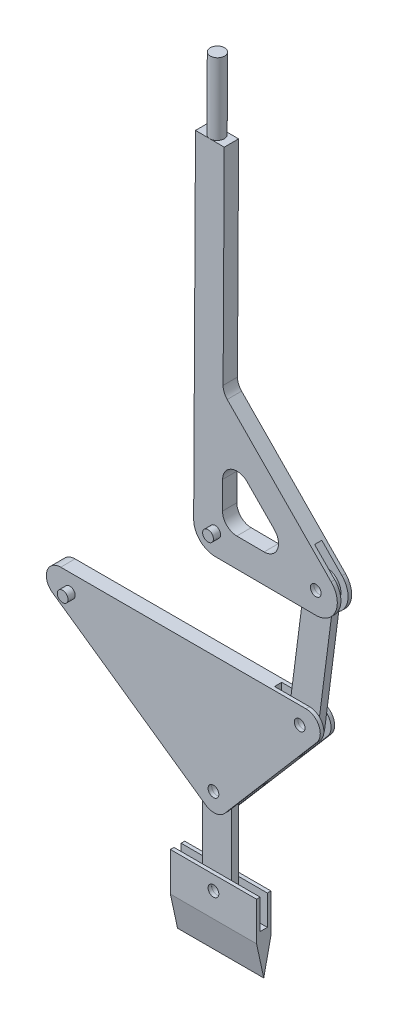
SolidWorks part; units mm, degrees
other "Blade"
other "Link2"
other "Link1"
other "Center Link"
other "Hand Link"
other "pin1"
other "pin2"
ref_plane "Front Plane" through (0, 0, 0) normal (0, 0, 1) x (1, 0, 0)
ref_plane "Top Plane" through (0, 0, 0) normal (0, 1, 0) x (1, 0, 0)
ref_plane "Right Plane" through (0, 0, 0) normal (1, 0, 0) x (0, 0, -1)
sketch "Center link" plane through (0, 0, 0) normal (0, 0, 1) x (1, 0, 0)
  line L0 (0, 0) -> (254, -177.8) construction
  line L3 (254, -177.8) -> (406.4, 0) construction
  line L4 (406.4, 0) -> (0, 0) construction
  line L5 (417.445, 30.48) -> (-16.1156, 30.48)
  line L6 (-30.6816, -15.7285) -> (240.2939, -205.4113)
  line L7 (274.1449, -201.1329) -> (436.7302, -11.4501)
  line L8 (472.6702, 30.48) -> (-96.6937, 30.48) construction
  line L9 (259.1588, -218.6167) -> (472.6702, 30.48) construction
  line L10 (-96.6937, 30.48) -> (259.1588, -218.6167) construction
  arc A2 (417.445, 30.48) -> (436.7302, -11.4501) centre (417.445, 5.08) cw
  arc A3 (240.2939, -205.4113) -> (274.1449, -201.1329) centre (254.8598, -184.6028) ccw
  arc A4 (-16.1156, 30.48) -> (-30.6816, -15.7285) centre (-16.1156, 5.08) ccw
  circle A5 centre (0, 0) radius 9.525
  circle A6 centre (406.4, 0) radius 9.525
  circle A7 centre (254, -177.8) radius 9.525
  point P0 (0, 0)
  point P1 (254, -177.8)
  point P3 (406.4, 0)
  dimension "D2" = 25.4
  dimension "D6" = 19.05
  dimension "D3" = 406.4
  dimension "D4" = 177.8
  dimension "D5" = 152.4
  dimension "D1" = 30.48
sketch "Link 2" plane through (0, 0, 0) normal (0, 0, 1) x (1, 0, 0)
  line L0 (254, -177.8) -> (254, -330.2) construction
  line L1 (279.4, -177.8) -> (279.4, -330.2)
  line L2 (228.6, -177.8) -> (228.6, -330.2)
  arc A0 (279.4, -177.8) -> (228.6, -177.8) centre (254, -177.8) ccw
  arc A1 (228.6, -330.2) -> (279.4, -330.2) centre (254, -330.2) ccw
  circle A2 centre (254, -330.2) radius 9.525
  circle A3 centre (254, -177.8) radius 9.525
  circle A4 centre (254, -177.8) radius 9.525 construction
  point P3 (254, -254)
  dimension "D2" = 25.4
  dimension "D1" = 152.4
sketch "Blade" plane through (0, 0, 0) normal (0, 0, 1) x (1, 0, 0)
  line L0 (254, -177.8) -> (254, -330.2) construction
  line L1 (177.8, -304.8) -> (330.2, -304.8)
  line L2 (177.8, -304.8) -> (177.8, -431.8)
  line L3 (177.8, -431.8) -> (330.2, -431.8)
  line L4 (330.2, -304.8) -> (330.2, -431.8)
  circle A0 centre (254, -330.2) radius 9.525
  circle A1 centre (254, -330.2) radius 9.525 construction
  point P6 (254, -304.8)
  dimension "D1" = 152.4
  dimension "D2" = 127
  dimension "D3" = 25.4
sketch "Hand Link" plane through (0, 0, 0) normal (0, 0, 1) x (1, 0, 0)
  line L1 (222.2172, 818.5071) -> (273.0164, 818.2299)
  line L3 (295.2285, 233.9) -> (343.5024, 233.6366)
  line L4 (256.8519, 183.3087) -> (434.6519, 182.3385)
  line L6 (218.9603, 221.616) -> (222.2172, 818.5071)
  line L7 (269.9674, 259.4382) -> (270.2331, 308.1268)
  line L9 (278.2856, 434.5038) -> (462.0614, 247.1152)
  line L10 (313.7672, 325.7731) -> (361.7754, 276.8211)
  line L11 (271.0205, 452.4273) -> (273.0164, 818.2299)
  circle A0 centre (257.0597, 221.4081) radius 9.525
  circle A1 centre (434.8597, 220.4379) radius 9.525
  arc A3 (218.9603, 221.616) -> (256.8519, 183.3087) centre (257.0597, 221.4081) ccw
  arc A4 (434.6519, 182.3385) -> (462.0614, 247.1152) centre (434.8597, 220.4379) ccw
  arc A5 (218.9603, 221.616) -> (256.8519, 183.3087) centre (257.0597, 221.4081) ccw
  arc A7 (269.9674, 259.4382) -> (295.2285, 233.9) centre (295.3671, 259.2996) ccw
  arc A9 (434.6519, 182.3385) -> (462.0614, 247.1152) centre (434.8597, 220.4379) ccw
  arc A10 (278.2856, 434.5038) -> (271.0205, 452.4273) centre (296.4201, 452.2887) cw
  arc A11 (361.7754, 276.8211) -> (343.5024, 233.6366) centre (343.6409, 259.0362) cw
  arc A12 (313.7672, 325.7731) -> (270.2331, 308.1268) centre (295.6327, 307.9882) ccw
  point P0 (257.0597, 221.4081)
  point P1 (434.8597, 220.4379)
  point P28 (270.9634, 441.97)
  dimension "D1" = 19.05
  dimension "D2" = 25.4
  dimension "D3" = 25.4
  dimension "D4" = 25.4
  dimension "D8" = 38.1
  dimension "D9" = 38.1
  dimension "D5" = 50.8
  dimension "D6" = 50.8
  dimension "D7" = 50.8
  dimension "D10" = 177.8
  dimension "D11" = 635
sketch "Link 1" plane through (0, 0, 0) normal (0, 0, 1) x (1, 0, 0)
  line L0 (434.8597, 220.4379) -> (406.4, 0) construction
  line L1 (460.0507, 217.1857) -> (431.5909, -3.2523)
  line L2 (409.6688, 223.6902) -> (381.2091, 3.2523)
  arc A0 (460.0507, 217.1857) -> (409.6688, 223.6902) centre (434.8597, 220.4379) ccw
  arc A1 (381.2091, 3.2523) -> (431.5909, -3.2523) centre (406.4, 0) ccw
  circle A2 centre (434.8597, 220.4379) radius 9.525
  circle A3 centre (406.4, 0) radius 9.525
  point P4 (420.6299, 110.219)
  dimension "D2" = 19.05
  dimension "D1" = 50.8
extrude "Boss-Extrude1" add sketch "Blade" along normal mid plane 25.4 contours L3 L4 L1 L2 | A0
sketch "Sketch7" plane through (177.8, 0, 0) normal (-1, 0, 0) x (0, 0, 1)
  line L0 (0, -431.8) -> (12.7, -373.0751)
  line L1 (12.7, -431.8) -> (-12.7, -431.8) construction
  line L2 (12.7, -304.8) -> (12.7, -431.8) construction
  line L3 (0, -431.8) -> (-12.7, -373.0751)
  line L4 (-12.7, -304.8) -> (-12.7, -431.8) construction
extrude "Cut-Extrude2" cut sketch "Sketch7" against normal through all and the other way through all
sketch "Sketch8" plane through (177.8, 0, 0) normal (-1, 0, 0) x (0, 0, 1)
  line L0 (0, -177.8) -> (0, -330.2) construction
  line L1 (6.35, -250.5495) -> (-6.35, -250.5495)
  line L2 (6.35, -250.5495) -> (6.35, -357.4599)
  line L3 (6.35, -357.4599) -> (-6.35, -357.4599)
  line L4 (-6.35, -250.5495) -> (-6.35, -357.4599)
  line L5 (6.35, -250.5495) -> (-6.35, -357.4599) construction
  line L6 (6.35, -357.4599) -> (-6.35, -250.5495) construction
  point P0 (0, -304.0047)
  dimension "D1" = 12.7
extrude "Cut-Extrude3" cut sketch "Sketch8" against normal through all contours L3 L4 L1 L2
extrude "Boss-Extrude2" add sketch "Link 2" along normal mid plane 12.7 separate body contours L1 A1 L2 A0
extrude "Boss-Extrude3" add sketch "Link 1" along normal mid plane 12.7 separate body contours L2 A1 L1 A0
extrude "Boss-Extrude4" add sketch "Center link" along normal mid plane 25.4 separate body contours L7 A2 L5 A4 L6 A3
extrude "Boss-Extrude5" add sketch "Hand Link" along normal mid plane 25.4 separate body contours L9 A10 L11 L1 L6 A3 L4 A4 A12 L10 A11 L3 A7 L7 A0 A1
sketch "Sketch9" plane through (4.4726, 819.6952, 0) normal (0.0055, 1, 0) x (1, -0.0055, 0)
  line L0 (217.7478, 12.7) -> (268.5478, -12.7) construction
  circle A0 centre (243.1478, 0) radius 12.7
  dimension "D1" = 25.4
extrude "Boss-Extrude6" add sketch "Sketch9" along normal blind 127
sketch "Sketch10" plane through (0, 0, 0) normal (0, 0, 1) x (1, 0, 0)
  line L0 (383.8534, 182.6157) -> (384.0597, 220.4379)
  line L1 (256.8519, 183.3087) -> (434.6519, 182.3385) construction
  line L2 (399.29, 256.7069) -> (426.4918, 283.3842)
  line L3 (278.2856, 434.5038) -> (462.0614, 247.1152) construction
  line L4 (383.8534, 182.6157) -> (424.1675, 170.7759)
  line L5 (426.4918, 283.3842) -> (461.4849, 263.7016)
  line L6 (-30.6816, -15.7285) -> (240.2939, -205.4113) construction
  line L7 (135.5283, -132.0754) -> (333.3371, -132.0754)
  line L8 (135.5283, -132.0754) -> (135.5283, -236.2181)
  line L9 (135.5283, -236.2181) -> (333.3371, -236.2181)
  line L10 (333.3371, -132.0754) -> (333.3371, -236.2181)
  line L11 (274.1449, -201.1329) -> (436.7302, -11.4501) construction
  line L12 (396.4819, -58.4064) -> (373.3398, -38.5702)
  line L13 (355.6, 30.48) -> (355.6, 0)
  line L14 (417.445, 30.48) -> (-16.1156, 30.48) construction
  line L15 (396.4819, -58.4064) -> (421.3294, -48.5567)
  line L16 (355.6, 30.48) -> (377.7616, 41.9581)
  circle A0 centre (434.8597, 220.4379) radius 50.8
  circle A1 centre (406.4, 0) radius 50.8
  dimension "D1" = 101.6
  dimension "D2" = 101.6
extrude "Cut-Extrude4" cut sketch "Sketch10" against normal mid plane 12.7 contours A1 L12 L15 | A1 | A1 L16 L13 | L10 L7 L8 L9 | L5 A0 L0 L4 | A0 L5 L2 | A0 L0 L4
sketch "Sketch11" plane through (0, 0, 0) normal (0, 0, 1) x (1, 0, 0)
  circle A0 centre (0, 0) radius 9.525 construction
  circle A1 centre (257.0597, 221.4081) radius 9.525 construction
  circle A2 centre (0, 0) radius 9.525
  circle A3 centre (257.0597, 221.4081) radius 9.525
extrude "Boss-Extrude7" add sketch "Sketch11" along normal mid plane 50.8 separate body
other "Save Bodies1"
